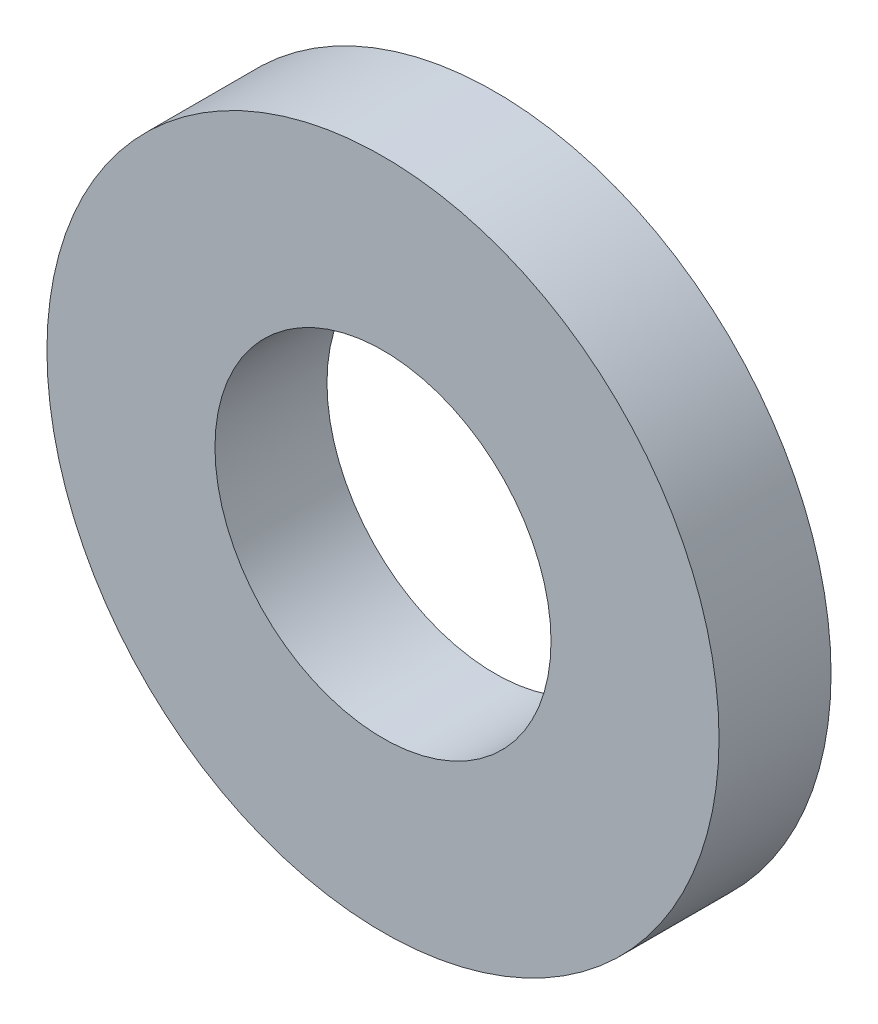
SolidWorks part; units mm, degrees
ref_plane "Front Plane" through (0, 0, 0) normal (0, 0, 1) x (1, 0, 0)
ref_plane "Top Plane" through (0, 0, 0) normal (0, 1, 0) x (1, 0, 0)
ref_plane "Right Plane" through (0, 0, 0) normal (1, 0, 0) x (0, 0, -1)
sketch "Sketch1" plane through (0, 0, 0) normal (0, 0, 1) x (1, 0, 0)
  circle A0 centre (0, 0) radius 4.7625
  circle A1 centre (0, 0) radius 9.525
  dimension "D1" = 9.525
  dimension "D2" = 19.05
extrude "5906K533 .75\" od x .375 id" add sketch "Sketch1" against normal blind 3.175
